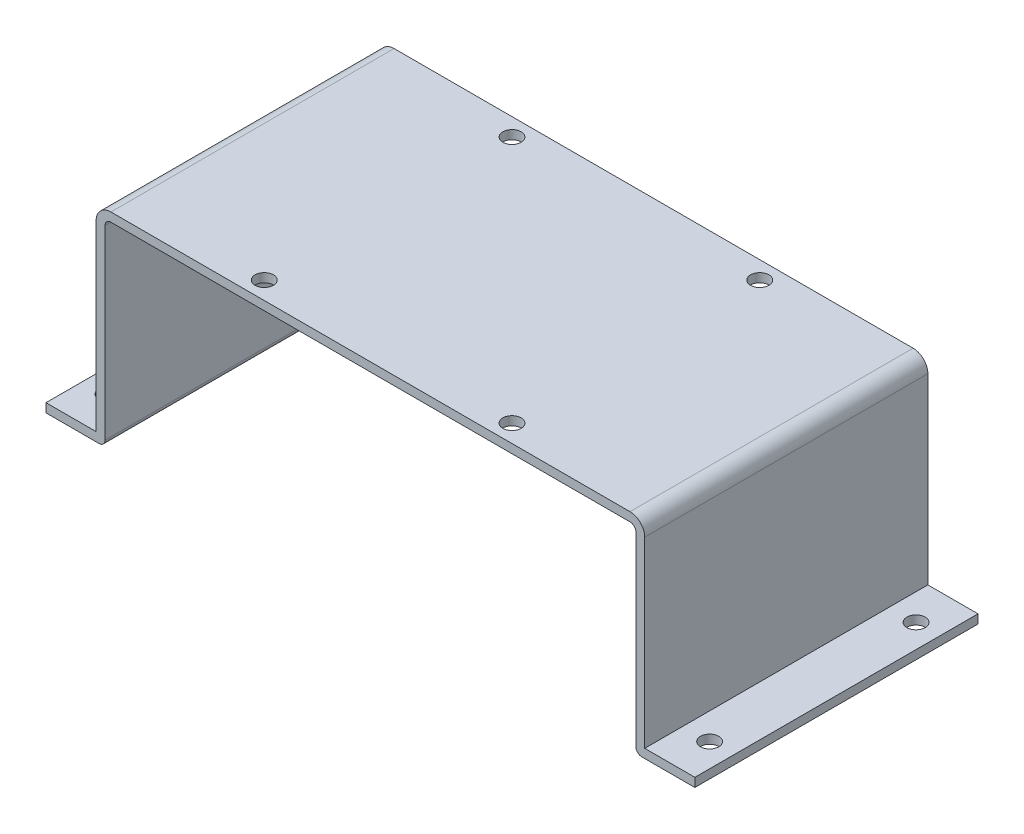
SolidWorks part; units mm, degrees
ref_plane "前视基准面" through (0, 0, 0) normal (0, 0, 1) x (1, 0, 0)
ref_plane "上视基准面" through (0, 0, 0) normal (0, 1, 0) x (1, 0, 0)
ref_plane "右视基准面" through (0, 0, 0) normal (1, 0, 0) x (0, 0, -1)
sketch "草图1" plane through (0, 0, 0) normal (0, 0, 1) x (1, 0, 0)
  line L0 (-44, 33.5) -> (44, 33.5)
  line L1 (45, 32.5) -> (45, 1)
  line L2 (46, 0) -> (55, 0)
  line L3 (0, 0) -> (0, 34.5093) construction
  line L4 (-46, 0) -> (-55, 0)
  line L5 (-45, 32.5) -> (-45, 1)
  arc A0 (45, 1) -> (46, 0) centre (46, 1) ccw
  arc A1 (44, 33.5) -> (45, 32.5) centre (44, 32.5) cw
  arc A2 (-44, 33.5) -> (-45, 32.5) centre (-44, 32.5) ccw
  arc A3 (-45, 1) -> (-46, 0) centre (-46, 1) cw
  point P9 (45, 0)
  point P12 (45, 33.5)
  point P20 (0, 33.5)
  dimension "D4" = 1
  dimension "D1" = 45
  dimension "D2" = 33.5
  dimension "D3" = 10
extrude "拉伸-薄壁1" add sketch "草图1" along normal mid plane 48 thin
sketch "草图3" plane through (0, 35, 0) normal (0, 1, 0) x (1, 0, 0)
  line L0 (0, 0) -> (0, 35.8899) construction
  line L1 (0, 0) -> (-66.9739, 0) construction
  line L3 (-46.5, 24) -> (-55, 24) construction
  circle A0 centre (-21, 21) radius 1.55
  circle A1 centre (21, 21) radius 1.55
  circle A2 centre (21, -21) radius 1.55
  circle A3 centre (-21, -21) radius 1.55
  circle A4 centre (-51, 17.5) radius 1.55
  circle A5 centre (51, 17.5) radius 1.55
  circle A6 centre (-51, -17.5) radius 1.55
  circle A7 centre (51, -17.5) radius 1.55
  point P19 (0, 0)
  dimension "D1" = 3.1
  dimension "D2" = 42
  dimension "D3" = 42
  dimension "D4" = 4
  dimension "D6" = 6.5
  dimension "D7" = 3.1
  dimension "D8" = 51
extrude "切除-拉伸1" cut sketch "草图3" against normal blind 45
